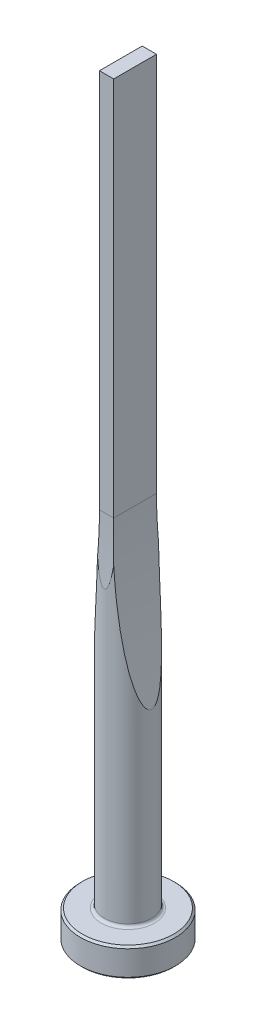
SolidWorks part; units mm, degrees
ref_plane "Front Plane" through (0, 0, 0) normal (0, 0, 1) x (1, 0, 0)
ref_plane "Top Plane" through (0, 0, 0) normal (0, 1, 0) x (1, 0, 0)
ref_plane "Right Plane" through (0, 0, 0) normal (1, 0, 0) x (0, 0, -1)
sketch "Sketch1" plane through (0, 0, 0) normal (0, 0, 1) x (1, 0, 0)
  line L0 (0, 0) -> (4.8, 0)
  line L1 (55, 0) -> (-55, 0) construction
  line L2 (5, 0.2) -> (5, 2.8)
  line L3 (4.8, 3) -> (2.8, 3)
  line L4 (2.5, 3.3) -> (2.5, 80)
  line L5 (0, 80) -> (2.5, 80)
  line L6 (5, 2.8) -> (4.8, 3)
  line L7 (4.8, 0) -> (5, 0.2)
  line L8 (0, 80) -> (0, 0)
  arc A0 (2.5, 3.3) -> (2.8, 3) centre (2.8, 3.3) ccw
  point P1 (5, 0)
  point P6 (5, 3)
  dimension "D4" = 0.3
  dimension "D1" = 2.5
  dimension "D2" = 5
  dimension "D3" = 3
  dimension "D5" = 80
revolve "Revolve1" add sketch "Sketch1" angle 360 about L8
sketch "Sketch2" plane through (0, 0, 0) normal (0, 0, 1) x (1, 0, 0)
  line L0 (0.75, 80) -> (0.75, 40)
  line L1 (2.5, 80) -> (-2.5, 80) construction
  line L2 (-0.75, 80) -> (-0.75, 40)
  line L3 (2.5, 80) -> (2.5, 22.3382)
  line L4 (-2.5, 80) -> (-2.5, 22.3382)
  line L5 (0, -5.5) -> (0, 5.5) construction
  line L6 (2.5, 80) -> (0.75, 80)
  line L8 (-0.75, 80) -> (-2.5, 80)
  arc A0 (0.75, 40) -> (2.5, 22.3382) centre (90.75, 40) ccw
  arc A1 (-0.75, 40) -> (-2.5, 22.3382) centre (-90.75, 40) cw
  dimension "D4" = 90
  dimension "D1" = 40
  dimension "D2" = 1.5
  dimension "D3" = 0.75
extrude "Cut-Extrude1" cut sketch "Sketch2" against normal mid plane 10
sketch "Sketch3" plane through (0, 0, 0) normal (1, 0, 0) x (0, 0, -1)
  line L0 (2.25, 80) -> (2.25, 40)
  line L1 (-2.3848, 80) -> (2.3848, 80) construction
  line L2 (-2.25, 80) -> (-2.25, 40)
  line L3 (2.5, 80) -> (2.5, 33.2965)
  line L4 (2.25, 80) -> (2.5, 80)
  line L5 (0, 5.5) -> (0, -5.5) construction
  line L6 (-2.5, 80) -> (-2.5, 33.2965)
  line L8 (-2.25, 80) -> (-2.5, 80)
  arc A0 (2.25, 40) -> (2.5, 33.2965) centre (92.25, 40) ccw
  arc A1 (-2.25, 40) -> (-2.5, 33.2965) centre (-92.25, 40) cw
  dimension "D2" = 90
  dimension "D1" = 40
  dimension "D3" = 4.5
  dimension "D4" = 2.25
extrude "Cut-Extrude2" cut sketch "Sketch3" against normal mid plane 10
